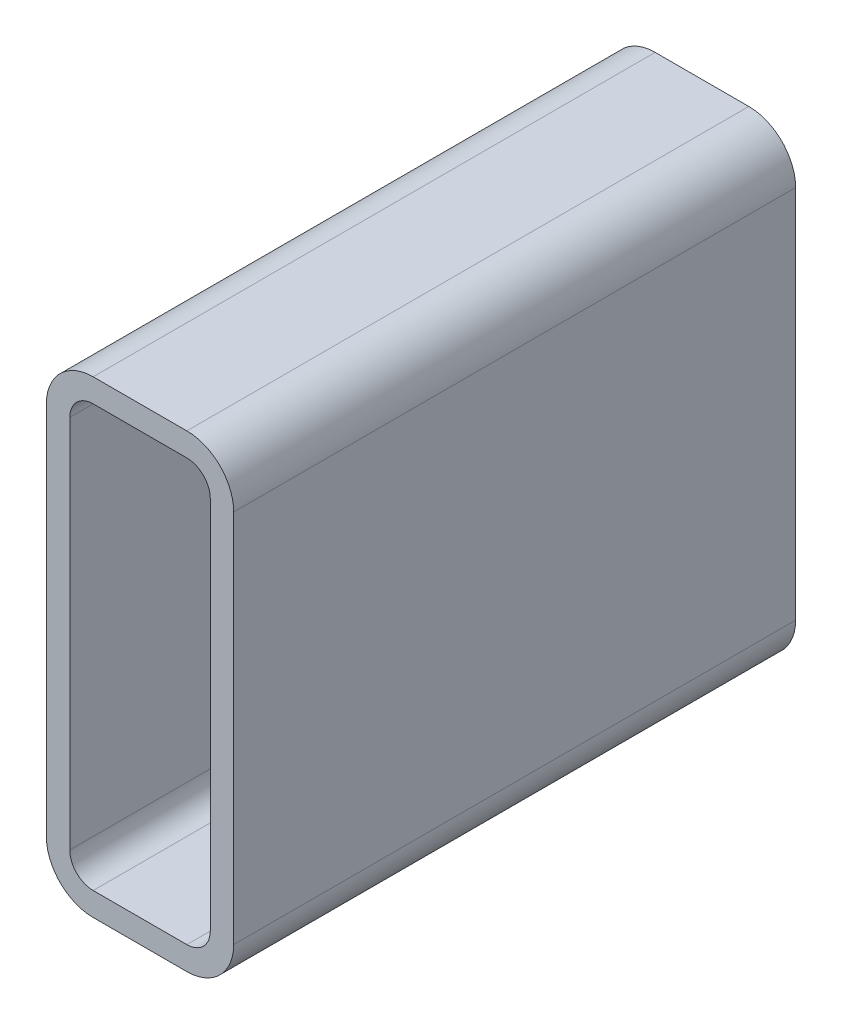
SolidWorks part; units mm, degrees
ref_plane "Front Plane" through (0, 0, 0) normal (0, 0, 1) x (1, 0, 0)
ref_plane "Top Plane" through (0, 0, 0) normal (0, 1, 0) x (1, 0, 0)
ref_plane "Right Plane" through (0, 0, 0) normal (1, 0, 0) x (0, 0, -1)
sketch "Sketch1" plane through (0, 0, 0) normal (0, 0, 1) x (1, 0, 0)
sketch_block_instance "HSS10x4x0.500-1"
sketch_block "HSS10x4x0.500"
extrude "Boss-Extrude1" add sketch "Sketch1" along normal blind 304.8
